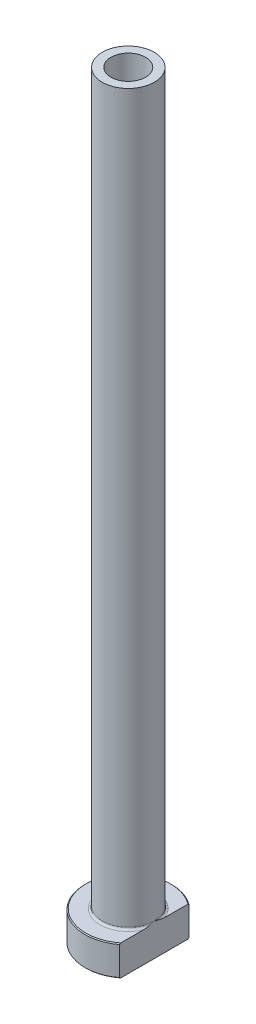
SolidWorks part; units mm, degrees
ref_plane "Front Plane" through (0, 0, 0) normal (0, 0, 1) x (1, 0, 0)
ref_plane "Top Plane" through (0, 0, 0) normal (0, 1, 0) x (1, 0, 0)
ref_plane "Right Plane" through (0, 0, 0) normal (1, 0, 0) x (0, 0, -1)
sketch "Sketch1" plane through (0, 0, 0) normal (0, 0, 1) x (1, 0, 0)
  line L0 (-4, 175) -> (-6, 175)
  line L1 (-6, 175) -> (-6, 7)
  line L2 (-6, 7) -> (-10, 7)
  line L3 (-10, 7) -> (-10, 0)
  line L4 (8.8, 0) -> (-8.8, 0) construction
  line L5 (-10, 0) -> (-4.25, 0)
  line L6 (-4, 130) -> (-4, 175)
  line L7 (0, 92.1877) -> (0, -15.5353) construction
  line L8 (0, -11) -> (0, 11) construction
  line L9 (-4, 130) -> (-4.25, 118)
  line L10 (-4.25, 118) -> (-4.25, 0)
  dimension "D1" = 0.25
  dimension "ID" = 8
  dimension "OD" = 12
  dimension "L" = 175
  dimension "H" = 20
  dimension "T" = 7
  dimension "N" = 45
  dimension "D2" = 12
  dimension "L-N" = 130
revolve "Revolve1" add sketch "Sketch1" angle 360 about L7
fillet "Fillet1" radius 0.5 1 edges at (0, 7, 6)
chamfer "Chamfer1" distance 0.2 angle 45 2 edges at (0, 7, 10) (0, 0, 10)
sketch "Sketch2" plane through (0, 0, 0) normal (0, -1, 0) x (1, 0, 0)
  line L0 (6, 8) -> (6, -8)
  circle A0 centre (0, 0) radius 10 construction
  arc A1 (6, 8) -> (6, -8) centre (0, 0) cw
  circle A2 centre (0, 0) radius 6 construction
extrude "Cut-Extrude1" cut sketch "Sketch2" against normal through all
chamfer "Chamfer2" distance 0.5 angle 45 1 edges at (0, 0, 4.25)
